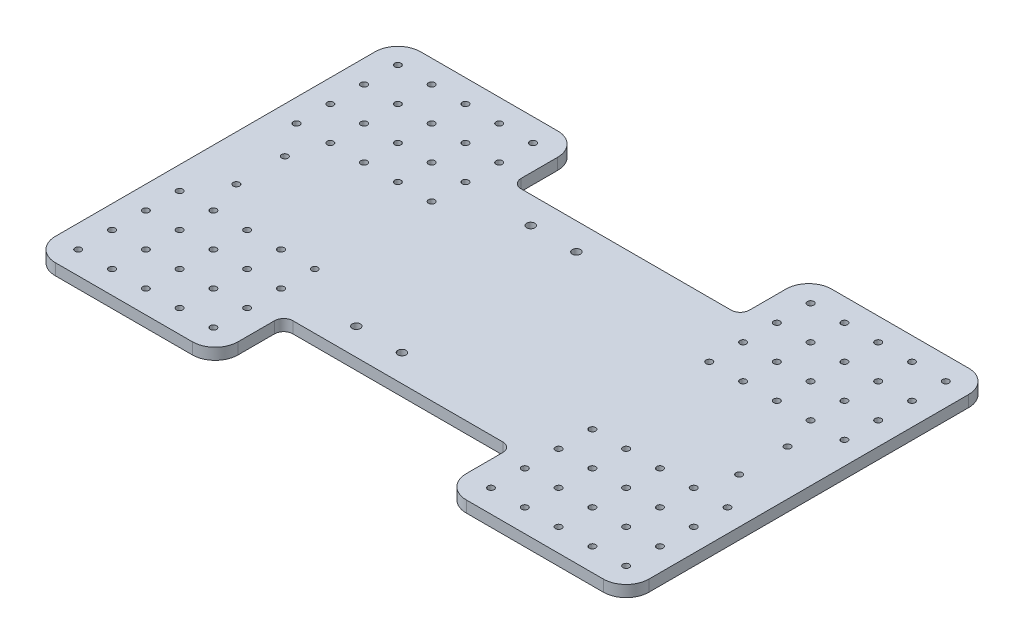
SolidWorks part; units mm, degrees
ref_plane "Front Plane" through (0, 0, 0) normal (0, 0, 1) x (1, 0, 0)
ref_plane "Top Plane" through (0, 0, 0) normal (0, 1, 0) x (1, 0, 0)
ref_plane "Right Plane" through (0, 0, 0) normal (1, 0, 0) x (0, 0, -1)
sketch "Sketch2" plane through (0, 0, 0) normal (0, 1, 0) x (1, 0, 0)
  line L1 (-82.55, -50.8) -> (82.55, -50.8)
  line L2 (-82.55, -50.8) -> (-82.55, 50.8)
  line L3 (-82.55, 50.8) -> (82.55, 50.8)
  line L4 (82.55, -50.8) -> (82.55, 50.8)
  line L5 (-82.55, -50.8) -> (82.55, 50.8) construction
  line L6 (-82.55, 50.8) -> (82.55, -50.8) construction
  point P0 (0, 0)
  dimension "D1" = 165.1
  dimension "D2" = 101.6
extrude "Boss-Extrude1" add sketch "Sketch2" along normal blind 3.175
sketch "Sketch6" plane through (0, 0, 50.8) normal (0, 0, 1) x (1, 0, 0)
  line L0 (-31.75, 3.175) -> (-31.75, 0)
  line L1 (82.55, 3.175) -> (82.55, 0) construction
  line L2 (-82.55, 3.175) -> (82.55, 3.175) construction
  line L3 (-82.55, 0) -> (82.55, 0) construction
  line L4 (-31.75, 0) -> (31.75, 0)
  line L5 (31.75, 3.175) -> (-31.75, 3.175)
  line L6 (31.75, 0) -> (31.75, 3.175)
  dimension "D1" = 63.5
  dimension "D2" = 50.8
extrude "Cut-Extrude2" cut sketch "Sketch6" against normal blind 19.05
mirror "Mirror2" about plane through (0, 0, 0) normal (0, 0, 1) of "Cut-Extrude2"
hole_wizard "#4-40 Tapped Hole3" positions "Sketch25" profile "Sketch24" tap size "#4-40" standard "ANSI Inch"
sketch "Sketch25" plane through (0, 3.175, 0) normal (0, 1, 0) x (1, 0, 0)
  line L0 (-6.35, 25.4) -> (82.55, 25.4) construction
  line L2 (82.55, -50.8) -> (82.55, 50.8) construction
  line L3 (82.55, 0) -> (-82.55, 0) construction
  line L4 (-82.55, 50.8) -> (-82.55, -50.8) construction
  line L6 (-6.35, -25.4) -> (82.55, -25.4) construction
  line L8 (-6.35, 25.4) -> (-6.35, -25.4) construction
  circle A0 centre (-6.35, 24.257) radius 1.143
  circle A1 centre (-6.35, -24.257) radius 1.143
  point P7 (-6.35, 24.257)
  point P9 (-6.35, -24.257)
  point P42 (-6.35, 0)
  point P43 (-19.05, 24.257)
  point P45 (-19.05, -24.257)
  dimension "D1" = 2.286
  dimension "D2" = 88.9
  dimension "D3" = 50.8
  dimension "D4" = 12.7
sketch "Sketch24" plane through (-6.35, 3.175, -24.257) normal (1, 0, 0) x (0, 0, 1)
  line L0 (0, 0) -> (0, 3.175)
  line L1 (0, 3.175) -> (1.1303, 3.175)
  line L2 (1.1303, 3.175) -> (1.1303, 0)
  line L5 (1.1303, 0) -> (0, 0)
  line L11 (0, -6.35) -> (0, 107.95) construction
  dimension "Thread Major Dia." = 2.2606
  dimension "Thru Tap Drill Depth" = 3.175
hole_wizard "#2-56 Tapped Hole1" positions "Sketch27" profile "Sketch26" tap size "#2-56" standard "ANSI Inch"
sketch "Sketch27" plane through (0, 0, 0) normal (0, -1, 0) x (-1, 0, 0)
  point P0 (69.9208, -6.731)
  point P3 (69.9208, 6.731)
sketch "Sketch26" plane through (-69.9208, 0, 6.731) normal (1, 0, 0) x (0, 0, -1)
  line L0 (0, 0) -> (0, 3.175)
  line L1 (0, 3.175) -> (0.889, 3.175)
  line L2 (0.889, 3.175) -> (0.889, 0)
  line L5 (0.889, 0) -> (0, 0)
  line L11 (0, -6.35) -> (0, 107.95) construction
  dimension "Thread Major Dia." = 1.778
  dimension "Thru Tap Drill Depth" = 3.175
fillet "Fillet1" radius 6.35 8 edges at (-82.55, 1.5875, -50.8) (-31.75, 1.5875, -50.8) (-82.55, 1.5875, 50.8) (-31.75, 1.5875, 50.8) (31.75, 1.5875, 50.8) (82.55, 1.5875, 50.8) (82.55, 1.5875, -50.8) (31.75, 1.5875, -50.8)
hole_wizard "#2-56 Tapped Hole2" positions "Sketch29" profile "Sketch28" tap size "#2-56" standard "ANSI Inch"
sketch "Sketch29" plane through (0, 3.175, 0) normal (0, 1, 0) x (1, 0, 0)
  point P133 (-76.2, 44.45)
sketch "Sketch28" plane through (-76.2, 3.175, -44.45) normal (1, 0, 0) x (0, 0, 1)
  line L0 (0, 0) -> (0, 3.175)
  line L1 (0, 3.175) -> (0.889, 3.175)
  line L2 (0.889, 3.175) -> (0.889, 0)
  line L5 (0.889, 0) -> (0, 0)
  line L11 (0, -6.35) -> (0, 107.95) construction
  dimension "Thread Major Dia." = 1.778
  dimension "Thru Tap Drill Depth" = 3.175
pattern_linear "LPattern1" count 5 spacing 9.398 along (1, 0, 0) count 4 spacing 9.398 along (0, 0, 1) of "#2-56 Tapped Hole2"
mirror "Mirror3" about plane through (0, 0, 0) normal (0, 0, 1) of "#2-56 Tapped Hole2", "LPattern1"
fillet "Fillet3" radius 2.54 4 edges at (31.75, 1.5875, -31.75) (-31.75, 1.5875, -31.75) (31.75, 1.5875, 31.75) (-31.75, 1.5875, 31.75)
ref_plane "Plane1" through (0, 0, 0) normal (-1, 0, 0) x (0, 0, 1)
mirror "Mirror4" about plane through (0, 0, 0) normal (-1, 0, 0) of "#2-56 Tapped Hole1", "Mirror3", "LPattern1", "#2-56 Tapped Hole2"
